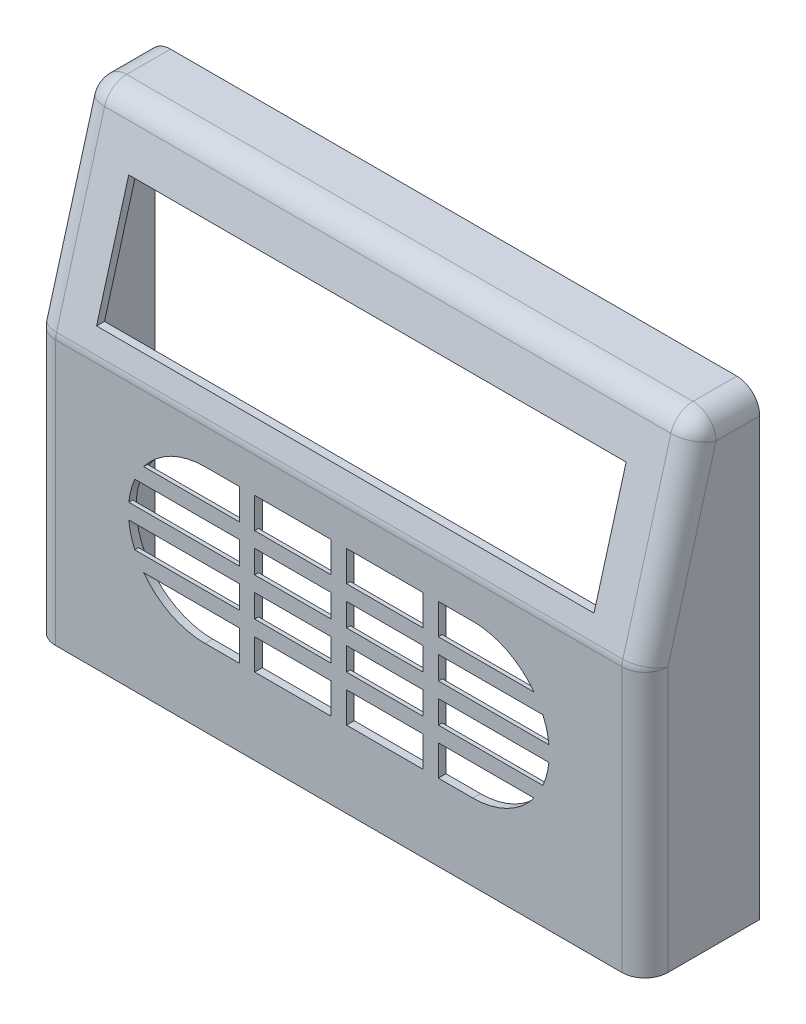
SolidWorks part; units mm, degrees
ref_plane "Front Plane" through (0, 0, 0) normal (0, 0, 1) x (1, 0, 0)
ref_plane "Top Plane" through (0, 0, 0) normal (0, 1, 0) x (1, 0, 0)
ref_plane "Right Plane" through (0, 0, 0) normal (1, 0, 0) x (0, 0, -1)
sketch "Sketch1" plane through (0, 0, 0) normal (1, 0, 0) x (0, 0, -1)
  line L0 (0, 0) -> (0, 60)
  line L1 (0, 60) -> (-8, 60)
  line L2 (-8, 60) -> (-15, 35)
  line L3 (-15, 35) -> (-15, 0)
  line L4 (-15, 0) -> (0, 0)
  dimension "D1" = 15
  dimension "D2" = 60
  dimension "D3" = 8
  dimension "D4" = 35
extrude "Boss-Extrude1" add sketch "Sketch1" along normal mid plane 80
fillet "Fillet1" radius 3 8 edges at (-40, 17.5, 15) (40, 17.5, 15) (40, 47.5, 11.5) (-40, 47.5, 11.5) (0, 35, 15) (0, 60, 8) (-40, 60, 4) (40, 60, 4)
shell "Shell1" thickness 1
ref_plane "Plane1" through (0, 0, 35) normal (0, 0, 1) x (1, 0, 0)
sketch "Sketch2" plane through (0, 0, 35) normal (0, 0, 1) x (1, 0, 0)
  line L0 (-17.5, 20) -> (17.5, 20) construction
  line L1 (-17.5, 30) -> (17.5, 30)
  line L2 (-17.5, 10) -> (17.5, 10)
  line L3 (-12, 30) -> (-12, 10)
  line L4 (0, 30) -> (0, 10)
  line L5 (12, 30) -> (12, 10)
  line L6 (-27.5, 20) -> (27.5, 20)
  line L7 (-26.1603, 15) -> (26.1603, 15)
  line L8 (-26.1603, 25) -> (26.1603, 25)
  line L9 (37, 0) -> (-37, 0) construction
  arc A0 (-17.5, 30) -> (-17.5, 10) centre (-17.5, 20) ccw
  arc A1 (17.5, 10) -> (17.5, 30) centre (17.5, 20) ccw
  point P2 (0, 20)
  dimension "D1" = 5
  dimension "D2" = 20
  dimension "D3" = 35
  dimension "D4" = 17.5
  dimension "D5" = 24
  dimension "D6" = 12
  dimension "D7" = 10
other "Vent1" parameters "RibsDepth"=1, "RibsWidth"=2, "RibsOffset"=0, "SparsDepth"=0.5, "SparsWidth"=2, "SparsOffset"=0, "D7"=1, "D8"=0, "Draft"=1
sketch "Sketch3" plane through (0, 0, 35) normal (0, 0, 1) x (1, 0, 0)
  line L0 (-37, 60) -> (37, 60) construction
  line L1 (-32.5, 53) -> (32.5, 53)
  line L2 (-32.5, 53) -> (-32.5, 38)
  line L3 (-32.5, 38) -> (32.5, 38)
  line L4 (32.5, 53) -> (32.5, 38)
  line L5 (-40, 34.5879) -> (-40, 57) construction
  dimension "D1" = 65
  dimension "D2" = 15
  dimension "D3" = 7
  dimension "D4" = 7.5
other "Vent2" parameters "D1"=1, "D2"=5, "D3"=0, "D4"=1, "D5"=2, "D6"=0, "D7"=1, "D8"=0, "D9"=1
